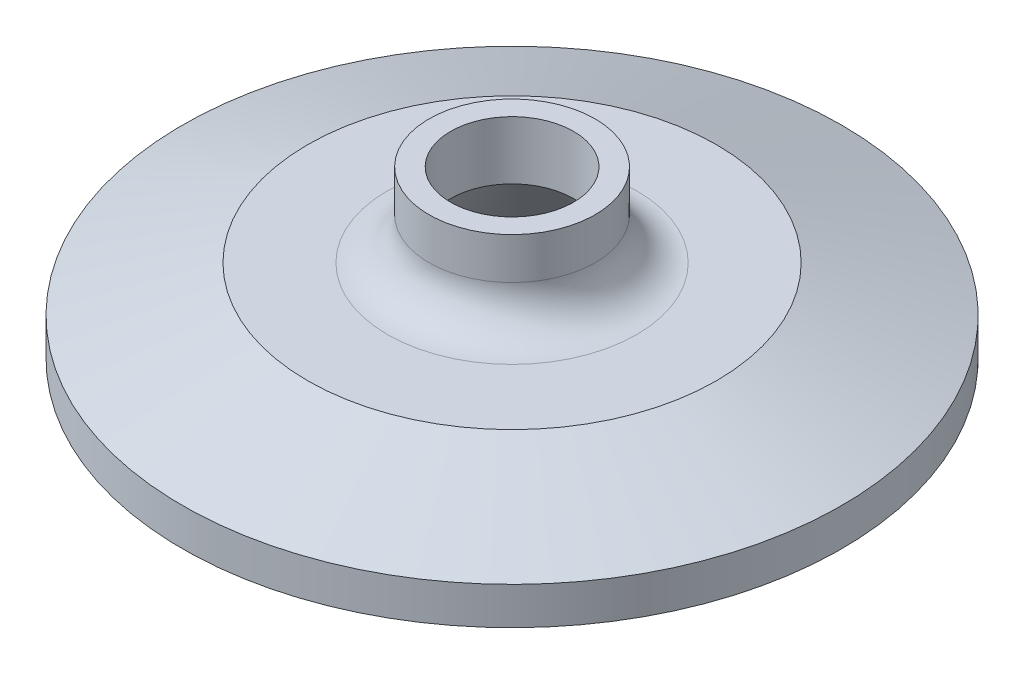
SolidWorks part; units mm, degrees
ref_plane "Front Plane" through (0, 0, 0) normal (0, 0, 1) x (1, 0, 0)
ref_plane "Top Plane" through (0, 0, 0) normal (0, 1, 0) x (1, 0, 0)
ref_plane "Right Plane" through (0, 0, 0) normal (1, 0, 0) x (0, 0, -1)
sketch "Sketch1" plane through (0, 0, 0) normal (0, 0, 1) x (1, 0, 0)
  line L0 (0, 0) -> (0, 8.8532) construction
  line L1 (-6.35, 12.7) -> (-6.35, 9.525)
  line L2 (-9.525, 6.35) -> (-15.6302, 6.35)
  line L3 (-15.6302, 6.35) -> (-25.1968, 2.868)
  line L4 (-25.1968, 2.868) -> (-25.1968, 0)
  line L5 (-25.1968, 0) -> (-23.8092, 0)
  line L6 (-19.828, 0) -> (-11.049, 0)
  line L10 (-11.049, 0) -> (-4.699, 8.2486)
  line L11 (-4.699, 8.2486) -> (-4.699, 12.7)
  line L12 (-4.699, 12.7) -> (-6.35, 12.7)
  line L15 (-22.9175, 0.8729) -> (-23.0844, 0.4797)
  line L17 (-20.7197, 0.8729) -> (-20.5528, 0.4797)
  arc A0 (-9.525, 6.35) -> (-6.35, 9.525) centre (-9.525, 9.525) ccw
  arc A1 (-23.0844, 0.4797) -> (-23.8092, 0) centre (-23.8092, 0.7874) cw
  arc A2 (-19.828, 0) -> (-20.5528, 0.4797) centre (-19.828, 0.7874) cw
  arc A3 (-20.7197, 0.8729) -> (-22.9175, 0.8729) centre (-21.8186, 0.4064) ccw
  dimension "D3" = 3.175
  dimension "D7" = 0.7874
  dimension "D8" = 21.8186
  dimension "D9" = 0.7874
  dimension "D2" = 4.699
  dimension "D4" = 12.7
  dimension "D5" = 6.35
  dimension "D6" = 25.1968
  dimension "D10" = 20
  dimension "D11" = 11.049
  dimension "D12" = 6.35
  dimension "D13" = 37.59
revolve "Revolve1" add sketch "Sketch1" angle 360 about L0
